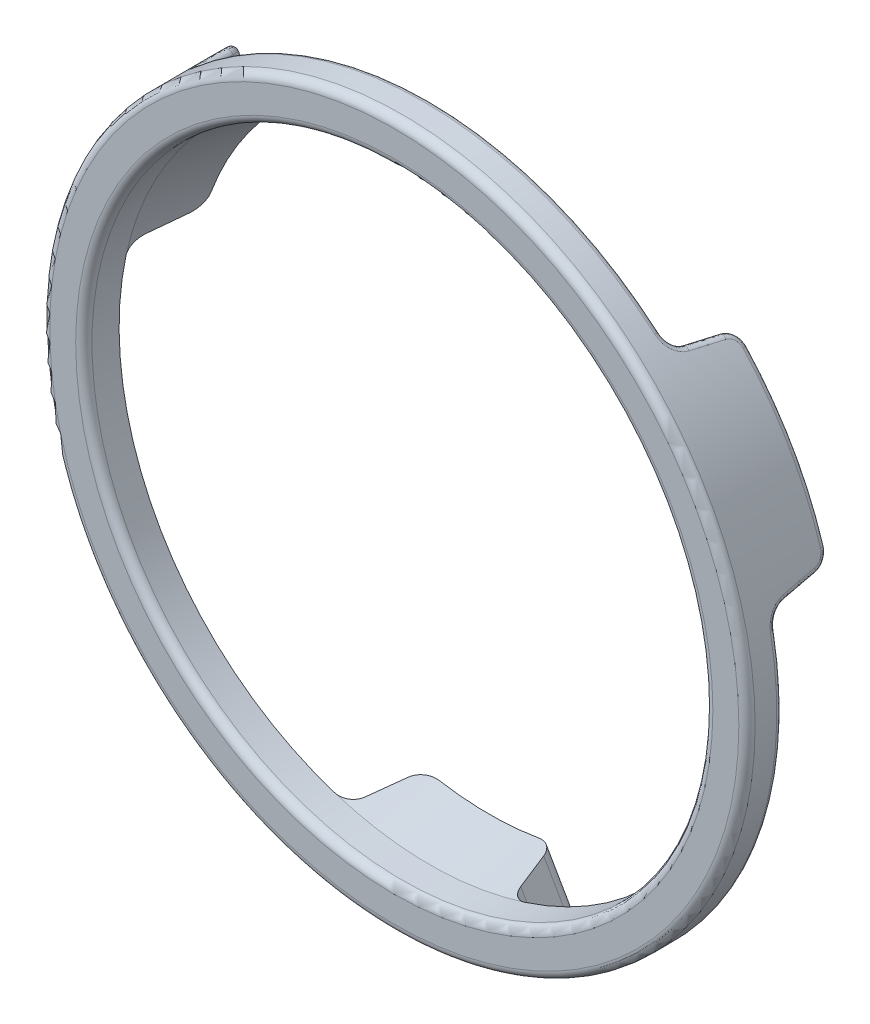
SolidWorks part; units mm, degrees
ref_plane "Plan de face" through (0, 0, 0) normal (0, 0, 1) x (1, 0, 0)
ref_plane "Plan de dessus" through (0, 0, 0) normal (0, 1, 0) x (1, 0, 0)
ref_plane "Plan de droite" through (0, 0, 0) normal (1, 0, 0) x (0, 0, -1)
sketch "Esquisse1" plane through (0, 0, 0) normal (0, 0, 1) x (1, 0, 0)
  circle A0 centre (0, 0) radius 130
  dimension "D1" = 260
extrude "Boss.-Extru.1" add sketch "Esquisse1" along normal blind 35
other "Empreinte1"
other "inté plein^Assemblage3<1>@Assemblage31"
other "moulos^Assemblage3<1>@Assemblage31"
sketch "Esquisse2" plane through (0, 0, 35) normal (0, 0, 1) x (1, 0, 0)
  circle A1 centre (0, 0) radius 114.426
  dimension "D1" = 228.8521
extrude "Enlèv. mat.-Extru.1" cut sketch "Esquisse2" against normal up to vertex
fillet "Congé1" radius 3 2 edges at (114.426, 0, 35) (130, 0, 35)
fillet "Congé2" radius 2 24 edges at (112.5833, 65, 0) (92.1814, 91.6656, 1.5603) (-92.3092, 91.537, 1.4073) (-90.0174, 93.7916, 10.9937) (-87.7977, 95.8726, 20.4609) (87.6416, 96.0153, 20.6383) (90.0174, 93.7916, 10.9937) (-125.4755, 33.9986, 1.5603) (-33.1188, -125.7106, 1.4073) (-36.2173, -124.8532, 10.9937) (-39.1293, -123.9714, 20.4609) (-126.9725, 27.8922, 20.6383) (-126.2346, 31.0615, 10.9937) (33.2941, -125.6643, 1.5603) (125.4279, 34.1736, 1.4073) (126.2346, 31.0615, 10.9937) (126.927, 28.0987, 20.4609) (39.3309, -123.9076, 20.6383) (36.2173, -124.8532, 10.9937) (-112.5833, -65, 22) (112.5833, -65, 22) (0, 130, 22) (-112.5833, 65, 0) (0, -130, 0)
